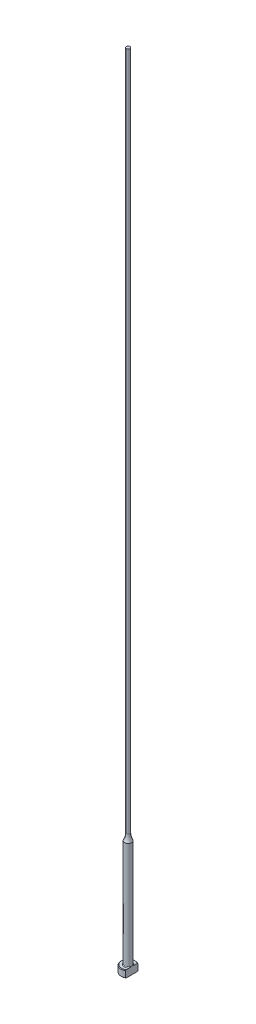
SolidWorks part; units mm, degrees
ref_plane "Front Plane" through (0, 0, 0) normal (0, 0, 1) x (1, 0, 0)
ref_plane "Top Plane" through (0, 0, 0) normal (0, 1, 0) x (1, 0, 0)
ref_plane "Right Plane" through (0, 0, 0) normal (1, 0, 0) x (0, 0, -1)
sketch "Sketch1" plane through (0, 0, 0) normal (0, 0, 1) x (1, 0, 0)
  line L0 (0, 259.9588) -> (0, -15.1925) construction
  line L1 (0, 0) -> (-3.175, 0)
  line L2 (-3.175, 0) -> (-3.175, 3.175)
  line L3 (-3.175, 3.175) -> (-1.5875, 3.175)
  line L4 (-0.7937, 53.8742) -> (-0.7937, 355.6)
  line L5 (-0.7937, 355.6) -> (0, 355.6)
  line L6 (0, 355.6) -> (0, 0)
  line L7 (-1.5875, 3.175) -> (-1.5875, 50.8)
  arc A0 (-1.5875, 50.8) -> (-0.7937, 53.8742) centre (-7.1437, 53.8742) ccw
  point P13 (-1.5875, 0)
  dimension "D1" = 6.35
  dimension "L" = 355.6
  dimension "D2" = 3.175
  dimension "H" = 6.35
  dimension "T" = 3.175
  dimension "D" = 1.5875
  dimension "S" = 50.8
revolve "Revolve1" add sketch "Sketch1" angle 360 about L0
chamfer "Chamfer1" distance 0.254 angle 45 2 edges at (0, 3.175, 3.175) (0, 0, 3.175)
fillet "Fillet1" radius 0.254 1 edges at (0, 3.175, 1.5875)
sketch "Sketch2" plane through (0, 0, 0) normal (0, 1, 0) x (1, 0, 0)
  line L0 (1.5875, -2.7496) -> (1.5875, 2.7496)
  circle A0 centre (0, 0) radius 3.175 construction
  arc A2 (1.5875, -2.7496) -> (1.5875, 2.7496) centre (0, 0) ccw
  circle A3 centre (0, 0) radius 3.175 construction
  circle A4 centre (0, 0) radius 1.5875 construction
extrude "Key Head" cut sketch "Sketch2" along normal up to next
